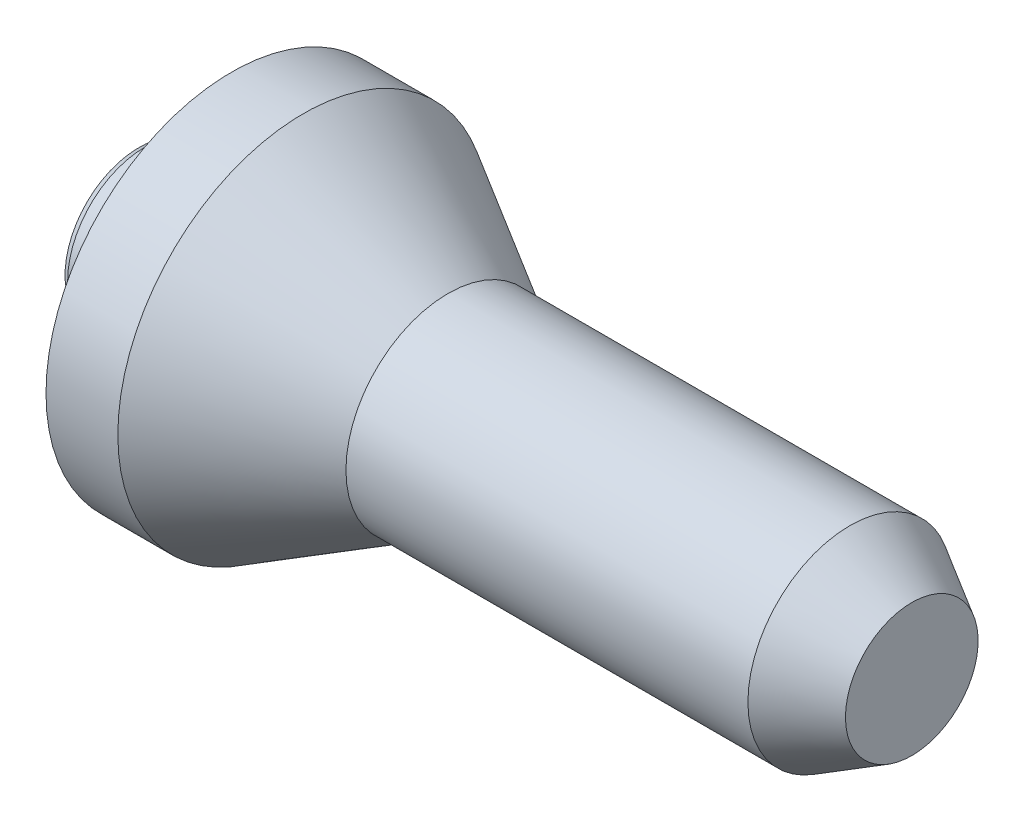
SolidWorks part; units mm, degrees
ref_plane "Plan de face" through (0, 0, 0) normal (0, 0, 1) x (1, 0, 0)
ref_plane "Plan de dessus" through (0, 0, 0) normal (0, 1, 0) x (1, 0, 0)
ref_plane "Plan de droite" through (0, 0, 0) normal (1, 0, 0) x (0, 0, -1)
sketch "Esquisse1" plane through (0, 0, 0) normal (0, 0, 1) x (1, 0, 0)
  line L0 (-16.4655, 0) -> (129.9065, 0) construction
  line L1 (0, 0) -> (0, 12.5)
  line L2 (0, 12.5) -> (15, 12.5)
  line L3 (15, 12.5) -> (15, 30)
  line L4 (50, 16.5) -> (115, 16.5)
  line L5 (115, 16.5) -> (125, 10.7265)
  line L6 (125, 10.7265) -> (125, 0)
  line L7 (125, 0) -> (0, 0)
  line L8 (50, 16.5) -> (26.6173, 30)
  line L9 (26.6173, 30) -> (15, 30)
  dimension "D1" = 25
  dimension "D2" = 33
  dimension "D3" = 15
  dimension "D4" = 125
  dimension "D5" = 30
  dimension "D6" = 10
  dimension "D7" = 35
  dimension "D8" = 150
  dimension "D9" = 60
revolve "Révolution1" add sketch "Esquisse1" angle 360 about L0
hole_wizard "Trou taraudé M16" positions "Esquisse7" profile "Esquisse6" tap size "M16" standard "DIN"
sketch "Esquisse7" plane through (0, 0, 0) normal (-1, 0, 0) x (0, 0, 1)
  point P0 (0, 0)
sketch "Esquisse6" plane through (0, 0, 0) normal (0, 1, 0) x (0, 0, 1)
  line L0 (0, 0) -> (0, 49.206)
  line L1 (0, 49.206) -> (7, 45)
  line L2 (7, 45) -> (7, 1.25)
  line L3 (7, 1.25) -> (8.25, 0)
  line L5 (8.25, 0) -> (0, 0)
  line L6 (-7, 1.25) -> (-8.25, 0) construction
  line L10 (0, 49.206) -> (-7, 45) construction
  line L11 (0, -6.35) -> (0, 107.95) construction
  dimension "Diamètre du trou pour taraudage" = 14
  dimension "Profondeur du trou pour taraudage" = 45
  dimension "Diamètre du fraisage entrant" = 16.5
  dimension "Angle du fraisage entrant" = 90
  dimension "Angle de pointe" = 118
chamfer "Chanfrein1" distance 1 angle 30 1 edges at (0, 0, 12.5)
